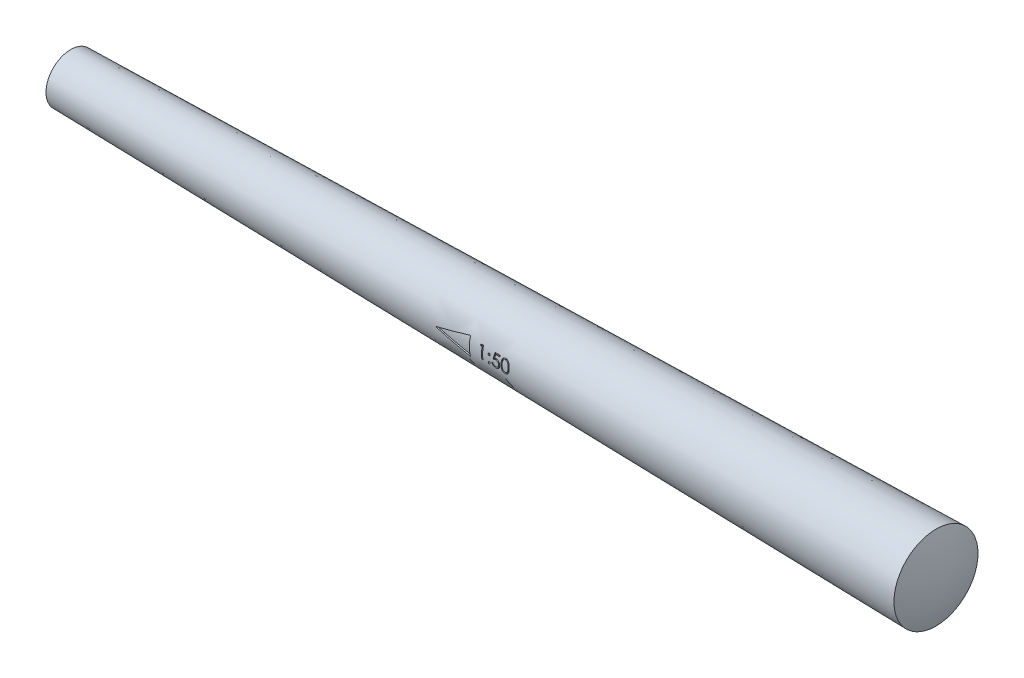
SolidWorks part; units mm, degrees
ref_plane "Front Plane" through (0, 0, 0) normal (0, 0, 1) x (1, 0, 0)
ref_plane "Top Plane" through (0, 0, 0) normal (0, 1, 0) x (1, 0, 0)
ref_plane "Right Plane" through (0, 0, 0) normal (1, 0, 0) x (0, 0, -1)
sketch "Sketch1" plane through (0, 0, 0) normal (1, 0, 0) x (0, 0, -1)
  circle A0 centre (0, 0) radius 2
  dimension "D1" = 4
extrude "Extrude1" add sketch "Sketch1" along normal mid plane 70
draft "Draft1" type of draft neutral plane draft angle 1.146 faces to draft 1 parameters "D1"=1.146
sketch "Sketch2" plane through (0, 0, 0) normal (0, 0, 1) x (1, 0, 0)
  line L0 (-35, 0) -> (-35, 2)
  line L1 (-35, 2) -> (-35, -2) construction
  line L2 (-35, 0) -> (-35.6, 0)
  line L3 (-35.6, 0) -> (-35.6, -2.7) construction
  line L4 (35, 0) -> (35, 3.4)
  line L5 (35, -3.4) -> (35, 3.4) construction
  line L6 (35, 0) -> (35.6, 0)
  line L7 (35.6, 0) -> (35.6, -2.7) construction
  line L8 (-35, -2) -> (35, -3.4) construction
  arc A0 (-35.6, 0) -> (-35, 2) centre (-31.9667, 0) cw
  arc A1 (35.6, 0) -> (35, 3.4) centre (25.6664, 0) ccw
  point P14 (0, -2.7)
revolve "Revolve1" add sketch "Sketch2" angle 360 about L2
sketch "Sketch5" plane through (0, 0, 0) normal (0, 0, 1) x (1, 0, 0)
  line L0 (0, 2.7) -> (0, -2.7) construction
  line L1 (35, 3.4) -> (-35, 2) construction
  line L2 (-35, -2) -> (35, -3.4) construction
ref_plane "Plane2" through (0, 0, 0) normal (-0.02, 0, 0.9998) x (0.9998, 0, 0.02)
sketch "Sketch6" plane through (0, 0, 0) normal (-0.02, 0, 0.9998) x (0.9998, 0, 0.02)
  line L0 (0, 0) -> (0, 0.75)
  line L1 (0, 2.7) -> (0, -2.7) construction
  line L2 (0, 0.75) -> (-2.799, 0)
  line L3 (-2.799, 0) -> (0, -0.75)
  line L4 (0, -0.75) -> (0, 0)
  line L5 (0, -0.375) -> (4, -0.375) construction
  text T0 "1:50" font "Century Gothic" height 1
  dimension "D1" = 1.5
  dimension "D2" = 30
  dimension "D3" = 4
wrap "Wrap2" sketch "Sketch6" wrap type deboss source sketch "Sketch6" thickness 0.1 parameters "D1"=0.1
equation "\"D2@Sketch2\" = \"D1@Sketch2\""
